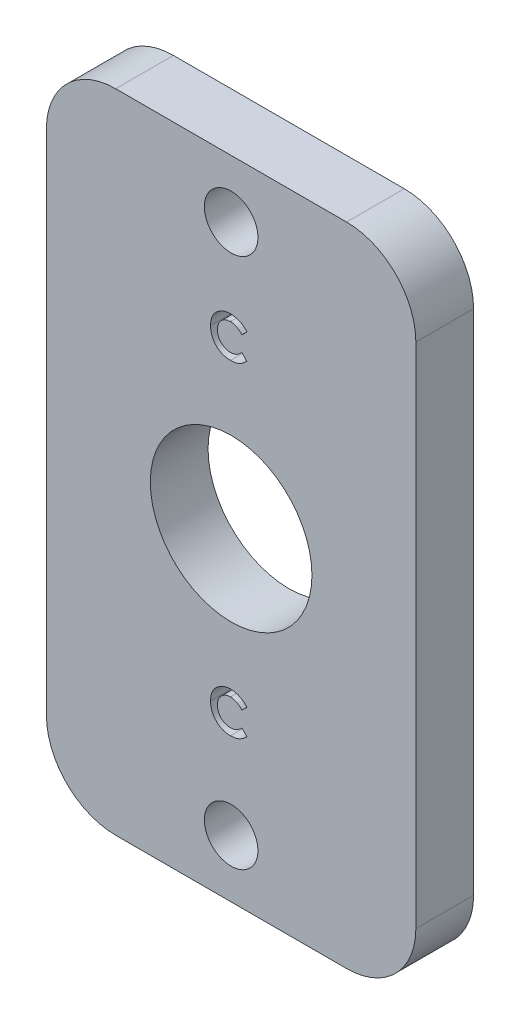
SolidWorks part; units mm, degrees
ref_plane "Front Plane" through (0, 0, 0) normal (0, 0, 1) x (1, 0, 0)
ref_plane "Top Plane" through (0, 0, 0) normal (0, 1, 0) x (1, 0, 0)
ref_plane "Right Plane" through (0, 0, 0) normal (1, 0, 0) x (0, 0, -1)
sketch "Sketch2" plane through (0, 0, 0) normal (0, 0, 1) x (1, 0, 0)
  line L1 (0, 0) -> (20.32, 0)
  line L2 (0, 0) -> (0, 35.56)
  line L3 (0, 35.56) -> (20.32, 35.56)
  line L4 (20.32, 0) -> (20.32, 35.56)
  circle A0 centre (10.16, 17.78) radius 4.445
  point P7 (10.16, 0)
  dimension "D3" = 8.89
  dimension "D1" = 20.32
  dimension "D2" = 35.56
  dimension "D4" = 17.78
extrude "Boss-Extrude1" add sketch "Sketch2" along normal blind 3.175
hole_wizard "#4 Clearance Hole1" positions "Sketch4" profile "Sketch3" hole size "#4" standard "ANSI Inch"
sketch "Sketch4" plane through (0, 0, 3.175) normal (0, 0, 1) x (1, 0, 0)
  line L0 (0, 0) -> (20.32, 0) construction
  line L5 (0, 0) -> (20.32, 0) construction
  line L6 (0, 35.56) -> (20.32, 35.56) construction
  point P0 (10.16, 3.175)
  point P2 (10.16, 32.385)
  point P6 (10.16, 0)
  dimension "D4" = 3.175
  dimension "D1" = 14.605
  dimension "D2" = 14.605
  dimension "D3" = 3.175
sketch "Sketch3" plane through (10.16, 3.175, 3.175) normal (1, 0, 0) x (0, -1, 0)
  line L0 (0, 0) -> (0, 3.302)
  line L1 (0, 3.302) -> (1.4732, 3.302)
  line L2 (1.4732, 3.302) -> (1.4732, 0)
  line L5 (1.4732, 0) -> (0, 0)
  line L10 (0, 3.302) -> (-1.4732, 3.302) construction
  line L11 (0, -6.35) -> (0, 107.95) construction
  dimension "Hole Dia." = 2.9464
  dimension "Hole Depth" = 3.302
  dimension "Drill Angle" = 180
fillet "Fillet1" radius 3.81 4 edges at (0, 0, 1.5875) (20.32, 0, 1.5875) (20.32, 35.56, 1.5875) (0, 35.56, 1.5875)
sketch "Sketch5" plane through (0, 0, 3.175) normal (0, 0, 1) x (1, 0, 0)
  text T0 "<b>C</b>" font "Century Gothic" height in points 8
  text T1 "<b>C</b>" font "Century Gothic" height in points 8
  dimension "D1" = 1.27
extrude "Cut-Extrude1" cut sketch "Sketch5" against normal through all
